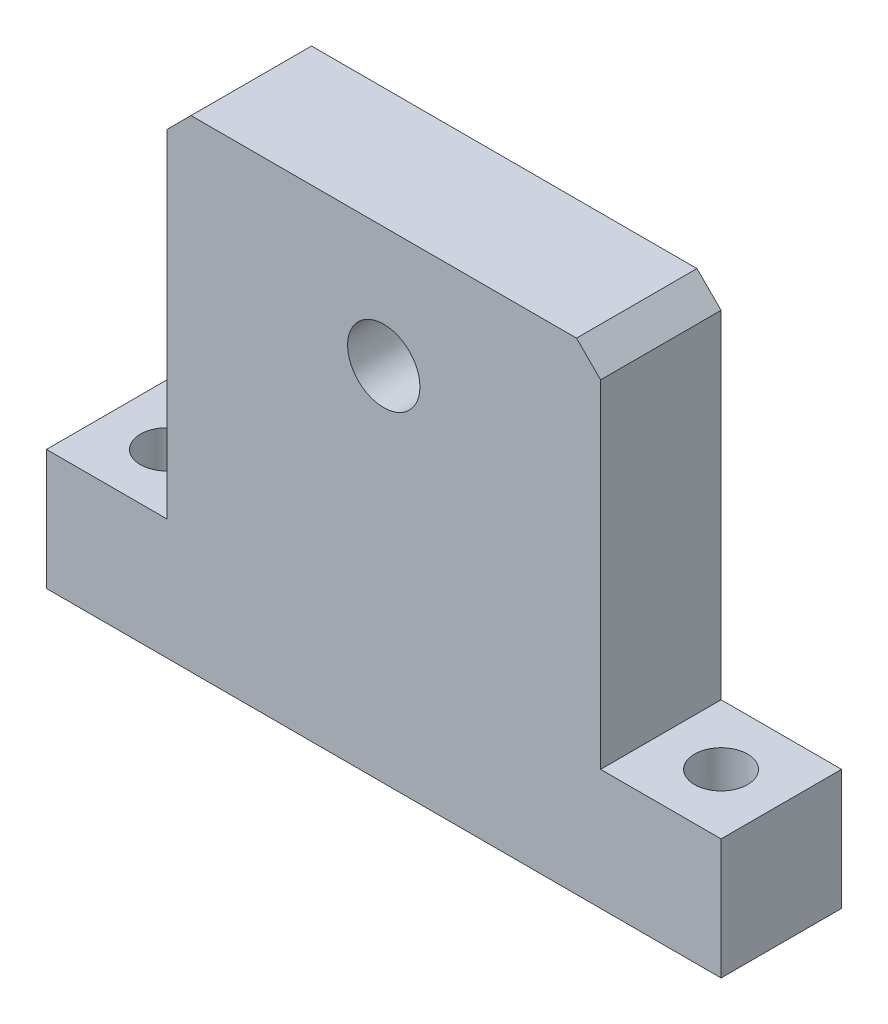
SolidWorks part; units mm, degrees
ref_plane "正面" through (0, 0, 0) normal (0, 0, 1) x (1, 0, 0)
ref_plane "平面" through (0, 0, 0) normal (0, 1, 0) x (1, 0, 0)
ref_plane "右側面" through (0, 0, 0) normal (1, 0, 0) x (0, 0, -1)
sketch "layout1" plane through (0, 0, 0) normal (0, 1, 0) x (1, 0, 0)
  line L0 (-57.5, 0) -> (57.5, 0) construction
  circle A0 centre (-57.5, 0) radius 5.5
  circle A1 centre (57.5, 0) radius 5.5
  dimension "D1" = 11
  dimension "D2" = 115
sketch "layout2" plane through (0, 0, 0) normal (0, 0, 1) x (1, 0, 0)
  line L0 (0, 0) -> (0, 75) construction
  circle A0 centre (0, 75) radius 7.5
  dimension "D1" = 15
  dimension "D2" = 75
sketch "ｽｹｯﾁ3" plane through (0, 0, 0) normal (0, 0, 1) x (1, 0, 0)
  line L1 (-70, 100) -> (70, 100)
  line L2 (-70, 100) -> (-70, 0)
  line L3 (-70, 0) -> (70, 0)
  line L4 (70, 100) -> (70, 0)
  dimension "D1" = 25
  dimension "D2" = 12.5
  dimension "D3" = 12.5
extrude "押し出し1" add sketch "ｽｹｯﾁ3" along normal mid plane 25
sketch "ｽｹｯﾁ4" plane through (0, 0, 12.5) normal (0, 0, 1) x (1, 0, 0)
  circle A0 centre (0, 75) radius 7.5 construction
  circle A1 centre (0, 75) radius 7.5
extrude "ｶｯﾄ - 押し出し1" cut sketch "ｽｹｯﾁ4" against normal through all
sketch "ｽｹｯﾁ5" plane through (0, 100, 0) normal (0, 1, 0) x (1, 0, 0)
  circle A0 centre (57.5, 0) radius 5.5 construction
  circle A1 centre (-57.5, 0) radius 5.5 construction
  circle A2 centre (57.5, 0) radius 5.5
  circle A3 centre (-57.5, 0) radius 5.5
extrude "ｶｯﾄ - 押し出し2" cut sketch "ｽｹｯﾁ5" against normal through all
sketch "ｽｹｯﾁ6" plane through (0, 0, 12.5) normal (0, 0, 1) x (1, 0, 0)
  line L1 (-70, 100) -> (-45, 100)
  line L2 (-70, 100) -> (-70, 25)
  line L3 (-70, 25) -> (-45, 25)
  line L4 (-45, 100) -> (-45, 25)
  line L5 (0, 0) -> (0, 75) construction
  line L6 (45, 100) -> (45, 25)
  line L7 (70, 25) -> (45, 25)
  line L8 (70, 100) -> (70, 25)
  line L9 (70, 100) -> (45, 100)
  line L10 (-57.5, 0) -> (57.5, 0) construction
  dimension "D1" = 25
  dimension "D2" = 25
  dimension "D3" = 25
extrude "ｶｯﾄ - 押し出し3" cut sketch "ｽｹｯﾁ6" against normal through all
chamfer "面取り1" distance 5 angle 45 2 edges at (-45, 100, 0) (45, 100, 0)
